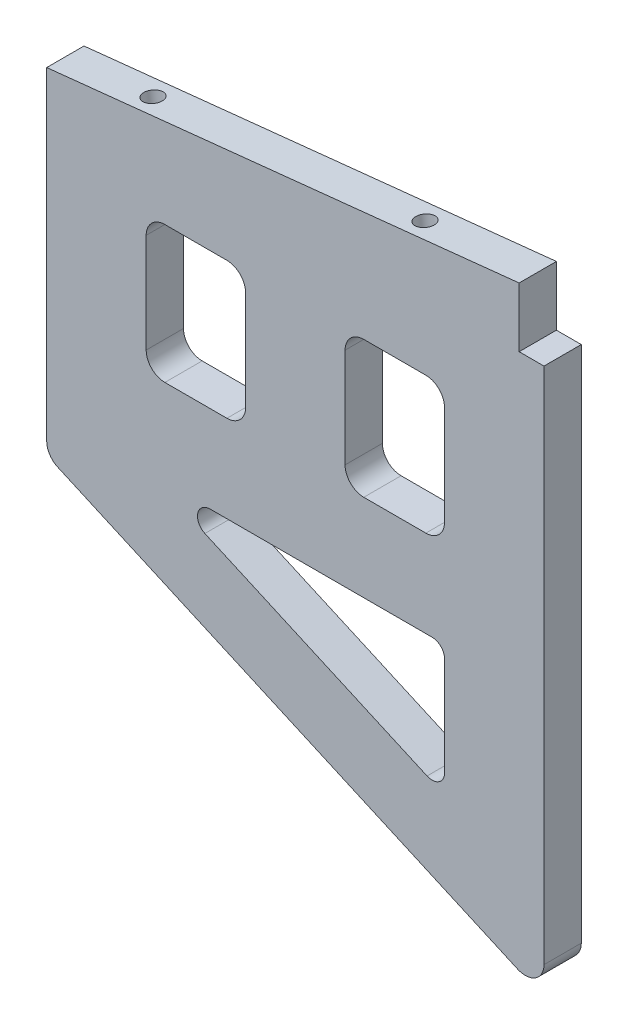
SolidWorks part; units mm, degrees
ref_plane "Front Plane" through (0, 0, 0) normal (0, 0, 1) x (1, 0, 0)
ref_plane "Top Plane" through (0, 0, 0) normal (0, 1, 0) x (1, 0, 0)
ref_plane "Right Plane" through (0, 0, 0) normal (1, 0, 0) x (0, 0, -1)
sketch "Sketch1" plane through (0, 0, 0) normal (0, 0, 1) x (1, 0, 0)
  line L0 (0, 0) -> (0, -85.725)
  line L1 (0, -85.725) -> (127, -142.269)
  line L2 (127, -142.269) -> (127, 13.3482)
  line L3 (127, 13.3482) -> (0, 0)
  line L4 (0, 0) -> (80.2605, 0) construction
  line L5 (22.3811, 2.3524) -> (23.7076, -10.2681) construction
  line L6 (91.8485, 9.6537) -> (92.9706, -1.0224) construction
  line L7 (120.65, 12.6808) -> (120.65, -2.5268)
  line L8 (120.65, -2.5268) -> (127, -2.5268)
  line L9 (26.7513, -76.7826) -> (101.6, -110.1074)
  line L10 (101.6, -110.1074) -> (101.6, -76.7826)
  line L11 (101.6, -76.7826) -> (26.7513, -76.7826)
  line L12 (25.4, -19.6326) -> (25.4, -54.5576)
  line L13 (25.4, -54.5576) -> (50.8, -54.5576)
  line L14 (50.8, -54.5576) -> (50.8, -19.6326)
  line L15 (50.8, -19.6326) -> (25.4, -19.6326)
  line L16 (76.2, -19.6326) -> (76.2, -54.5576)
  line L17 (76.2, -54.5576) -> (101.6, -54.5576)
  line L18 (101.6, -54.5576) -> (101.6, -19.6326)
  line L19 (101.6, -19.6326) -> (76.2, -19.6326)
  dimension "D1" = 6
  dimension "D2" = 24
  dimension "D3" = 127
  dimension "D4" = 85.725
  dimension "D5" = 22.5044
  dimension "D6" = 69.85
  dimension "D7" = 15.875
  dimension "D8" = 6.35
  dimension "D9" = 155.6173
  dimension "D10" = 25.4
  dimension "D11" = 25.4
  dimension "D12" = 25.4
  dimension "D13" = 19.05
  dimension "D14" = 25.4
  dimension "D15" = 33.3248
  dimension "D16" = 34.925
  dimension "D17" = 22.225
sketch "Sketch2" plane through (0, 0, 0) normal (0, 0, 1) x (1, 0, 0)
  line L0 (0, -85.725) -> (127, -142.269) construction
  line L1 (127, -142.269) -> (127, 13.3482) construction
  line L2 (127, 13.3482) -> (0, 0) construction
  line L3 (0, 0) -> (0, -85.725) construction
  line L4 (0, -85.725) -> (127, -142.269)
  line L5 (127, -142.269) -> (127, -2.5268)
  line L6 (120.65, 12.6808) -> (0, 0)
  line L7 (0, 0) -> (0, -85.725)
  line L8 (120.65, -2.5268) -> (127, -2.5268) construction
  line L9 (120.65, 12.6808) -> (120.65, -2.5268) construction
  line L10 (120.65, -2.5268) -> (127, -2.5268)
  line L11 (120.65, 12.6808) -> (120.65, -2.5268)
  line L12 (26.7513, -76.7826) -> (101.6, -110.1074) construction
  line L13 (101.6, -110.1074) -> (101.6, -76.7826) construction
  line L14 (101.6, -76.7826) -> (26.7513, -76.7826) construction
  line L15 (26.7513, -76.7826) -> (101.6, -110.1074)
  line L16 (101.6, -110.1074) -> (101.6, -76.7826)
  line L17 (101.6, -76.7826) -> (26.7513, -76.7826)
  line L18 (25.4, -54.5576) -> (50.8, -54.5576) construction
  line L19 (50.8, -54.5576) -> (50.8, -19.6326) construction
  line L20 (50.8, -19.6326) -> (25.4, -19.6326) construction
  line L21 (25.4, -19.6326) -> (25.4, -54.5576) construction
  line L22 (76.2, -54.5576) -> (101.6, -54.5576) construction
  line L23 (101.6, -54.5576) -> (101.6, -19.6326) construction
  line L24 (101.6, -19.6326) -> (76.2, -19.6326) construction
  line L25 (76.2, -19.6326) -> (76.2, -54.5576) construction
  line L26 (25.4, -54.5576) -> (50.8, -54.5576)
  line L27 (50.8, -54.5576) -> (50.8, -19.6326)
  line L28 (50.8, -19.6326) -> (25.4, -19.6326)
  line L29 (25.4, -19.6326) -> (25.4, -54.5576)
  line L30 (76.2, -54.5576) -> (101.6, -54.5576)
  line L31 (101.6, -54.5576) -> (101.6, -19.6326)
  line L32 (101.6, -19.6326) -> (76.2, -19.6326)
  line L33 (76.2, -19.6326) -> (76.2, -54.5576)
extrude "Boss-Extrude1" add sketch "Sketch2" along normal mid plane 9.525
hole_wizard "3/16 (0.1875) Diameter Hole1" positions "Sketch4" profile "Sketch3" hole size "3/16" standard "ANSI Inch"
sketch "Sketch4" plane through (0, 0, 0) normal (-0.1045, 0.9945, 0) x (0.9945, 0.1045, 0)
  point P0 (22.5044, 0)
  point P3 (92.3544, 0)
sketch "Sketch3" plane through (22.3811, 2.3524, 0) normal (0, 0, 1) x (-0.9945, -0.1045, 0)
  line L0 (0, 0) -> (0, 20.4808)
  line L1 (0, 20.4808) -> (2.3812, 19.05)
  line L2 (2.3812, 19.05) -> (2.3812, 0)
  line L5 (2.3812, 0) -> (0, 0)
  line L10 (0, 20.4808) -> (-2.3813, 19.05) construction
  line L11 (0, -6.35) -> (0, 107.95) construction
  dimension "Hole Dia." = 4.7625
  dimension "Hole Depth" = 19.05
  dimension "Drill Angle" = 118
fillet "Fillet1" radius 3.175 3 edges at (101.6, -76.7826, 0) (101.6, -110.1074, 0) (26.7513, -76.7826, 0)
fillet "Fillet2" radius 4.7752 8 edges at (101.6, -19.6326, 0) (101.6, -54.5576, 0) (76.2, -54.5576, 0) (76.2, -19.6326, 0) (50.8, -19.6326, 0) (50.8, -54.5576, 0) (25.4, -54.5576, 0) (25.4, -19.6326, 0)
fillet "Fillet3" radius 4.7752 2 edges at (127, -142.269, 0) (0, -85.725, 0)
